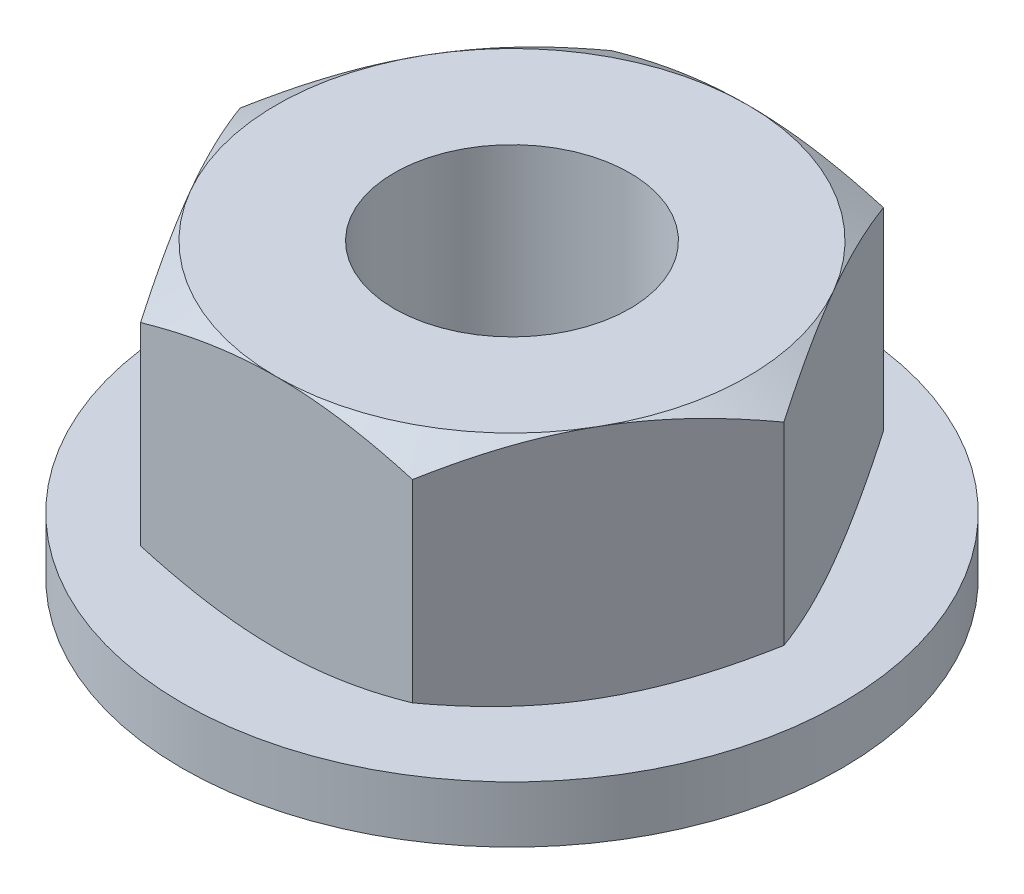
SolidWorks part; units mm, degrees
ref_plane "Plan de face" through (0, 0, 0) normal (0, 0, 1) x (1, 0, 0)
ref_plane "Plan de dessus" through (0, 0, 0) normal (0, 1, 0) x (1, 0, 0)
ref_plane "Plan de droite" through (0, 0, 0) normal (1, 0, 0) x (0, 0, -1)
sketch "Esquisse1" plane through (0, 0, 0) normal (0, 1, 0) x (1, 0, 0)
  line L1 (5.7735, 0) -> (2.8868, 5)
  line L2 (2.8868, 5) -> (-2.8868, 5)
  line L3 (-2.8868, 5) -> (-5.7735, 0)
  line L4 (-5.7735, 0) -> (-2.8868, -5)
  line L5 (-2.8868, -5) -> (2.8868, -5)
  line L6 (2.8868, -5) -> (5.7735, 0)
  circle A0 centre (0, 0) radius 5 construction
  dimension "D1" = 10
extrude "Extrusion1" add sketch "Esquisse1" along normal mid plane 5
sketch "Esquisse2" plane through (0, 0, 0) normal (1, 0, 0) x (0, 0, -1)
  line L0 (2, 4.2321) -> (8, 4.2321)
  line L1 (8, 4.2321) -> (8, 0.7679)
  line L2 (8, 0.7679) -> (2, 4.2321)
  line L3 (0, 9.378) -> (0, -1.3286) construction
  dimension "D1" = 30
  dimension "D2" = 3
revolve "Enlèvement de matière-Révolution4" cut sketch "Esquisse2" angle 360 about L3
mirror "Symétrie1" about plane through (0, 0, 0) normal (0, 1, 0) of "Enlèvement de matière-Révolution4"
sketch "Esquisse3" plane through (0, 2.5, 0) normal (0, 1, 0) x (-1, 0, 0)
  circle A0 centre (0, 0) radius 2.5
  dimension "D1" = 5
extrude "Enlèv. mat.-Extru.1" cut sketch "Esquisse3" against normal through all
sketch "Esquisse4" plane through (0, 0, 0) normal (0, 0, 1) x (1, 0, 0)
  line L0 (0, 0) -> (0, -4.728) construction
  line L1 (0, -2.5) -> (4.3301, -2.5) construction
  line L2 (3.5, -2.5) -> (7, -2.5)
  line L3 (3.5, -2.5) -> (3.5, -3.7)
  line L4 (3.5, -3.7) -> (7, -3.7)
  line L5 (7, -2.5) -> (7, -3.7)
  dimension "D1" = 1.2
  dimension "D2" = 7
  dimension "D3" = 14
revolve "Révolution1" add sketch "Esquisse4" angle 360 about L0
